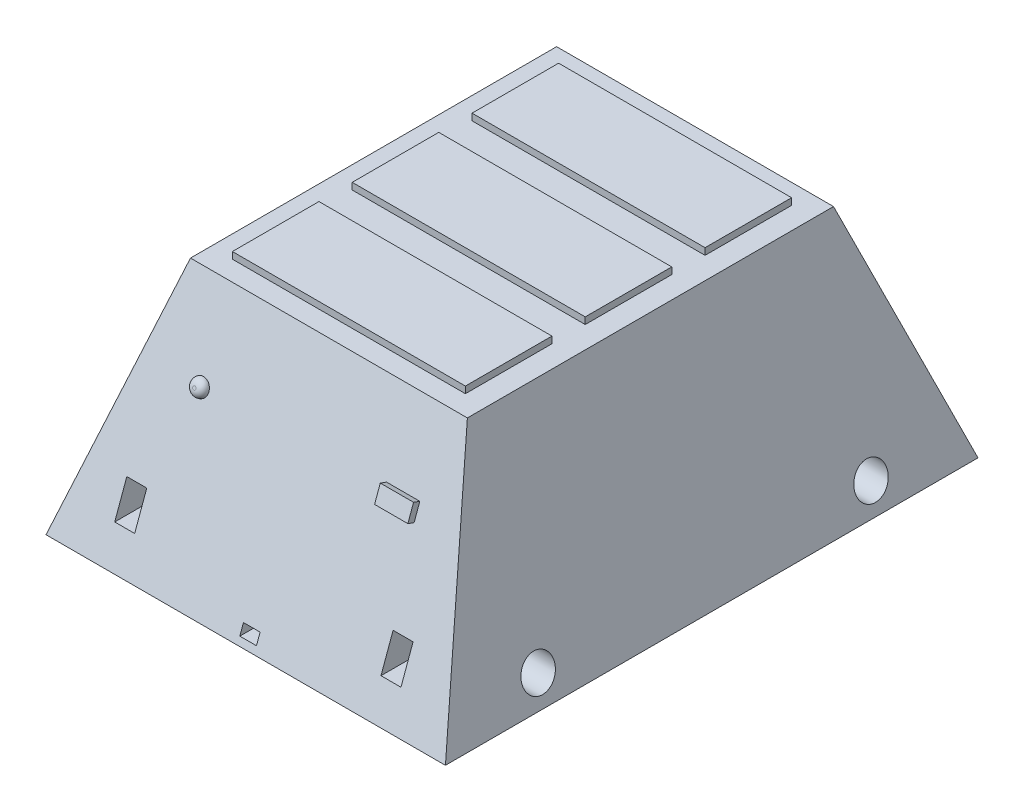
SolidWorks part; units mm, degrees
ref_plane "Front Plane" through (0, 0, 0) normal (0, 0, 1) x (1, 0, 0)
ref_plane "Top Plane" through (0, 0, 0) normal (0, 1, 0) x (1, 0, 0)
ref_plane "Right Plane" through (0, 0, 0) normal (1, 0, 0) x (0, 0, -1)
sketch "Sketch1" plane through (0, 0, 0) normal (1, 0, 0) x (0, 0, -1)
  line L0 (-101.6, -43.6162) -> (101.6, -43.6162)
  line L1 (101.6, -43.6162) -> (69.85, 43.6162)
  line L2 (69.85, 43.6162) -> (-69.85, 43.6162)
  line L3 (-69.85, 43.6162) -> (-101.6, -43.6162)
  line L4 (0, 43.6162) -> (0, -43.6162) construction
  point P6 (0, 0)
  dimension "D1" = 203.2
  dimension "D2" = 139.7
  dimension "D3" = 70
  dimension "D4" = 70
extrude "Boss-Extrude1" add sketch "Sketch1" along normal mid plane 152.4
draft "Draft2" type of draft neutral plane draft angle 15 faces to draft 2 parameters "D1"=15
sketch "Sketch2" plane through (0, 0, 0) normal (1, 0, 0) x (0, 0, -1)
  line L0 (-63.5, -33.4562) -> (63.5, -33.4562) construction
  line L1 (-101.6, -43.6162) -> (101.6, -43.6162) construction
  circle A0 centre (-63.5, -33.4562) radius 6.35
  circle A1 centre (63.5, -33.4562) radius 6.35
  point P4 (0, -33.4562)
  dimension "D3" = 12.7
  dimension "D1" = 10.16
  dimension "D2" = 127
extrude "Cut-Extrude1" cut sketch "Sketch2" against normal up to surface and the other way up to surface
sketch "Sketch3" plane through (0, 27.5515, 75.6971) normal (0, 0.342, 0.9397) x (1, 0, 0)
  line L0 (-38.1, -14.6543) -> (38.1, -14.6543) construction
  line L1 (31.75, -11.4793) -> (44.45, -11.4793)
  line L2 (31.75, -11.4793) -> (31.75, -17.8293)
  line L3 (31.75, -17.8293) -> (44.45, -17.8293)
  line L4 (44.45, -11.4793) -> (44.45, -17.8293)
  line L5 (31.75, -11.4793) -> (44.45, -17.8293) construction
  line L6 (31.75, -17.8293) -> (44.45, -11.4793) construction
  line L7 (52.8261, 17.0957) -> (-52.8261, 17.0957) construction
  circle A0 centre (-38.1, -14.6543) radius 3.175
  point P2 (38.1, -14.6543)
  point P7 (0, -14.6543)
  dimension "D1" = 6.35
  dimension "D2" = 12.7
  dimension "D3" = 6.35
  dimension "D4" = 76.2
  dimension "D5" = 31.75
extrude "Boss-Extrude2" add sketch "Sketch3" along normal blind 2.54
sketch "Sketch4" plane through (0, 43.6162, 0) normal (0, 1, 0) x (1, 0, 0)
  line L0 (-44.45, 16.51) -> (44.45, 16.51)
  line L1 (-44.45, 62.23) -> (44.45, 62.23)
  line L2 (-44.45, 62.23) -> (-44.45, 29.21)
  line L3 (-44.45, 29.21) -> (44.45, 29.21)
  line L4 (44.45, 62.23) -> (44.45, 29.21)
  line L5 (-44.45, 62.23) -> (44.45, 29.21) construction
  line L6 (-44.45, 29.21) -> (44.45, 62.23) construction
  line L7 (-44.45, 16.51) -> (-44.45, -16.51)
  line L8 (-44.45, -16.51) -> (44.45, -16.51)
  line L9 (44.45, 16.51) -> (44.45, -16.51)
  line L10 (-44.45, 16.51) -> (44.45, -16.51) construction
  line L11 (-44.45, -16.51) -> (44.45, 16.51) construction
  line L12 (-44.45, -29.21) -> (44.45, -29.21)
  line L13 (-44.45, -29.21) -> (-44.45, -62.23)
  line L14 (-44.45, -62.23) -> (44.45, -62.23)
  line L15 (44.45, -29.21) -> (44.45, -62.23)
  line L16 (-44.45, -29.21) -> (44.45, -62.23) construction
  line L17 (-44.45, -62.23) -> (44.45, -29.21) construction
  point P0 (0, 45.72)
  point P7 (0, 0)
  point P12 (0, -45.72)
  dimension "D2" = 88.9
  dimension "D3" = 33.02
  dimension "D4" = 12.7
  dimension "D1" = 3
extrude "Boss-Extrude3" add sketch "Sketch4" along normal blind 2.54
ref_plane "Plane1" through (0, 0, 69.85) normal (0, 0, 1) x (1, 0, 0)
sketch "Sketch5" plane through (0, 0, 69.85) normal (0, 0, 1) x (1, 0, 0)
  line L0 (-50.8, -24.5662) -> (50.8, -24.5662) construction
  line L1 (-54.61, -18.2162) -> (-46.99, -18.2162)
  line L2 (-54.61, -18.2162) -> (-54.61, -30.9162)
  line L3 (-54.61, -30.9162) -> (-46.99, -30.9162)
  line L4 (-46.99, -18.2162) -> (-46.99, -30.9162)
  line L5 (-54.61, -18.2162) -> (-46.99, -30.9162) construction
  line L6 (-54.61, -30.9162) -> (-46.99, -18.2162) construction
  line L7 (46.99, -18.2162) -> (54.61, -18.2162)
  line L8 (46.99, -18.2162) -> (46.99, -30.9162)
  line L9 (46.99, -30.9162) -> (54.61, -30.9162)
  line L10 (54.61, -18.2162) -> (54.61, -30.9162)
  line L11 (46.99, -18.2162) -> (54.61, -30.9162) construction
  line L12 (46.99, -30.9162) -> (54.61, -18.2162) construction
  line L13 (76.2, -43.6162) -> (-76.2, -43.6162) construction
  point P0 (-50.8, -24.5662)
  point P5 (50.8, -24.5662)
  point P12 (0, -24.5662)
  dimension "D1" = 19.05
  dimension "D2" = 101.6
  dimension "D3" = 7.62
  dimension "D4" = 12.7
extrude "Cut-Extrude2" cut sketch "Sketch5" along normal up to surface (22.5052 mm away)
sketch "Sketch6" plane through (0, 0, 69.85) normal (0, 0, 1) x (1, 0, 0)
  line L0 (76.2, -43.6162) -> (-76.2, -43.6162) construction
  line L1 (-3.175, -41.0762) -> (3.175, -41.0762)
  line L2 (-3.175, -41.0762) -> (-3.175, -37.2662)
  line L3 (-3.175, -37.2662) -> (3.175, -37.2662)
  line L4 (3.175, -41.0762) -> (3.175, -37.2662)
  line L5 (-3.175, -41.0762) -> (3.175, -37.2662) construction
  line L6 (-3.175, -37.2662) -> (3.175, -41.0762) construction
  point P0 (0, -39.1712)
  point P5 (-0.0868, -36.2127)
  point P6 (0, 0)
  dimension "D1" = 3.81
  dimension "D2" = 6.35
  dimension "D3" = 2.54
extrude "Cut-Extrude3" cut sketch "Sketch6" along normal up to surface (30.8255 mm away)
fillet "Fillet4" radius 2.54 1 edges at (-38.1, 11.6662, 84.1819)
